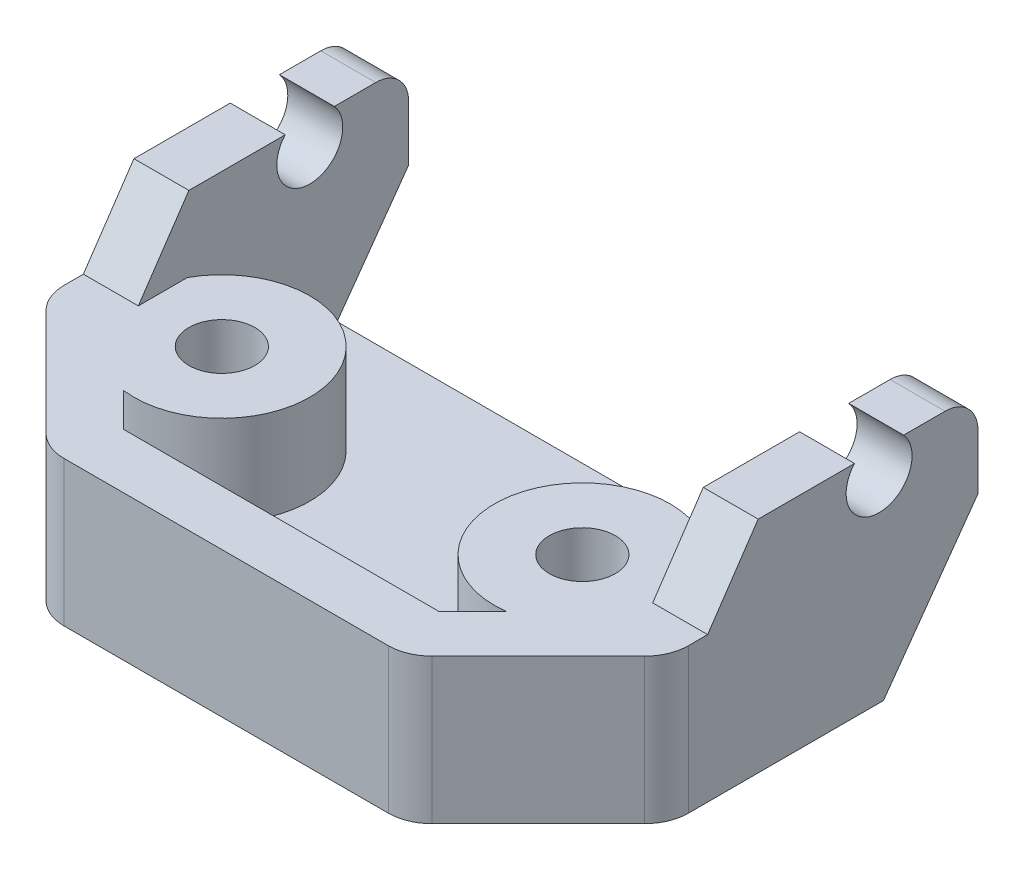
SolidWorks part; units mm, degrees
ref_plane "Plan de face" through (0, 0, 0) normal (0, 0, 1) x (1, 0, 0)
ref_plane "Plan de dessus" through (0, 0, 0) normal (0, 1, 0) x (1, 0, 0)
ref_plane "Plan de droite" through (0, 0, 0) normal (1, 0, 0) x (0, 0, -1)
sketch "Esquisse1" plane through (0, 0, 0) normal (0, 1, 0) x (1, 0, 0)
  line L0 (14.2, 0) -> (14.2, 20) construction
  line L1 (0, 0) -> (28.4, 0)
  line L2 (0, 0) -> (0, 20)
  line L3 (0, 20) -> (28.4, 20)
  line L4 (28.4, 0) -> (28.4, 20)
  circle A0 centre (22.4, 8) radius 1.5
  circle A1 centre (6, 8) radius 1.5
  dimension "D5" = 3
  dimension "D1" = 28.4
  dimension "D2" = 20
  dimension "D3" = 6
  dimension "D4" = 8
extrude "Extrusion1" add sketch "Esquisse1" along normal blind 10
chamfer "Chanfrein1" distance 6 angle 45 2 edges at (28.4, 5, 0) (0, 5, 0)
fillet "Congé1" radius 2 4 edges at (22.4, 5, 0) (6, 5, 0) (0, 5, -6) (28.4, 5, -6)
shell "Coque1" thickness 2.5
sketch "Esquisse2" plane through (28.4, 0, 0) normal (1, 0, 0) x (0, 0, -1)
  line L0 (15.7, 0) -> (20, 6)
  line L1 (6.8284, 0) -> (20, 0) construction
  line L2 (20, 10) -> (20, 0) construction
  line L3 (20, 6) -> (21.8279, 6)
  line L4 (21.8279, 6) -> (22.2125, -1.2259)
  line L5 (22.2125, -1.2259) -> (15.2879, -2.4594)
  line L6 (15.2879, -2.4594) -> (15.7, 0)
  line L7 (0, 0) -> (0, 10) construction
  dimension "D1" = 15.7
  dimension "D2" = 6
extrude "Enlèv. mat.-Extru.1" cut sketch "Esquisse2" against normal through all
sketch "Esquisse3" plane through (0, 10, 0) normal (0, 1, 0) x (-1, 0, 0)
  line L1 (-25.9, -9.9365) -> (-25.9, -17.5) construction
  line L2 (-25.9, -22.5835) -> (-2.5, -22.5835)
  line L3 (-25.9, -22.5835) -> (-25.9, -15.7)
  line L4 (-25.9, -15.7) -> (-2.5, -15.7)
  line L5 (-2.5, -22.5835) -> (-2.5, -15.7)
  line L6 (-2.5, -17.5) -> (-2.5, -9.9365) construction
  line L7 (-6.8284, 0) -> (-21.5716, 0) construction
  dimension "D1" = 15.7
extrude "Enlèv. mat.-Extru.2" cut sketch "Esquisse3" against normal through all
sketch "Esquisse5" plane through (28.4, 0, 0) normal (1, 0, 0) x (0, 0, -1)
  line L0 (20, 10) -> (20, 6) construction
  line L1 (6.8284, 0) -> (15.7, 0) construction
  circle A0 centre (15.5, 9) radius 1.5
  dimension "D1" = 4.5
  dimension "D2" = 3
  dimension "D3" = 9
extrude "Enlèv. mat.-Extru.3" cut sketch "Esquisse5" against normal through all
sketch "Esquisse7" plane through (28.4, 0, 0) normal (1, 0, 0) x (0, 0, -1)
  line L0 (10, 10) -> (7.7, 6.6)
  line L1 (6.8284, 10) -> (14.382, 10) construction
  line L2 (7.7, 6.6) -> (-1.8063, 6.6)
  line L3 (-1.8063, 6.6) -> (-1.8063, 12.9467)
  line L4 (-1.8063, 12.9467) -> (10, 12.9467)
  line L5 (10, 12.9467) -> (10, 10)
  line L7 (20, 10) -> (20, 6) construction
  line L8 (5.4142, 0) -> (0.5858, 0) construction
  point P10 (3, 0)
  dimension "D1" = 10
  dimension "D2" = 12.3
  dimension "D3" = 6.6
extrude "Enlèv. mat.-Extru.4" cut sketch "Esquisse7" against normal through all
sketch "Esquisse8" plane through (0, 10, 0) normal (0, 1, 0) x (-1, 0, 0)
  line L0 (-25.9, -10) -> (-25.9, -14.382) construction
  line L1 (-25.9, -12.191) -> (-2.5, -12.191)
  line L2 (-25.9, -12.191) -> (-25.9, 1.6882)
  line L3 (-25.9, 1.6882) -> (-2.5, 1.6882)
  line L4 (-2.5, -12.191) -> (-2.5, 1.6882)
extrude "Enlèv. mat.-Extru.5" cut sketch "Esquisse8" against normal up to surface (3.4 mm away)
fillet "Congé2" radius 1.5 2 edges at (1.25, 10, -20) (27.15, 10, -20)
